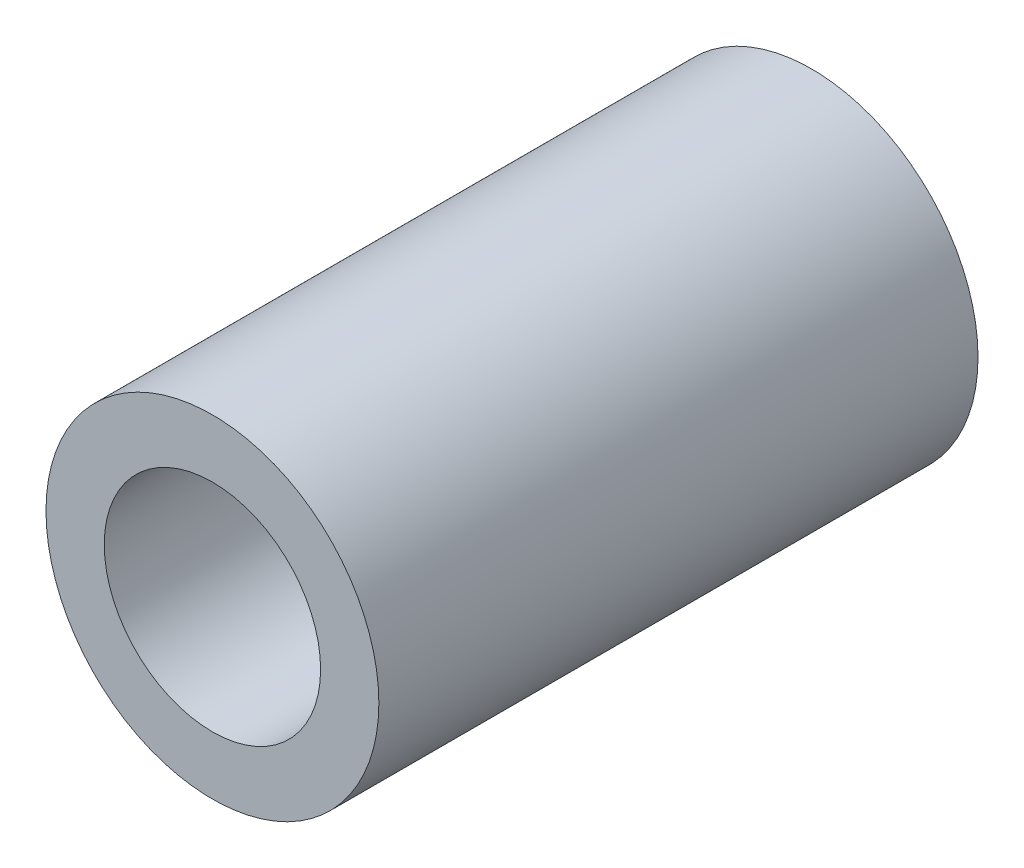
SolidWorks part; units mm, degrees
ref_plane "Спереди" through (0, 0, 0) normal (0, 0, 1) x (1, 0, 0)
ref_plane "Сверху" through (0, 0, 0) normal (0, 1, 0) x (1, 0, 0)
ref_plane "Справа" through (0, 0, 0) normal (1, 0, 0) x (0, 0, -1)
sketch "Эскиз1" plane through (0, 0, 0) normal (0, 0, 1) x (1, 0, 0)
  circle A0 centre (0, 0) radius 3.25
  circle A1 centre (0, 0) radius 5
  dimension "D1" = 6.5
  dimension "D2" = 10
extrude "Бобышка-Вытянуть1" add sketch "Эскиз1" along normal blind 18
